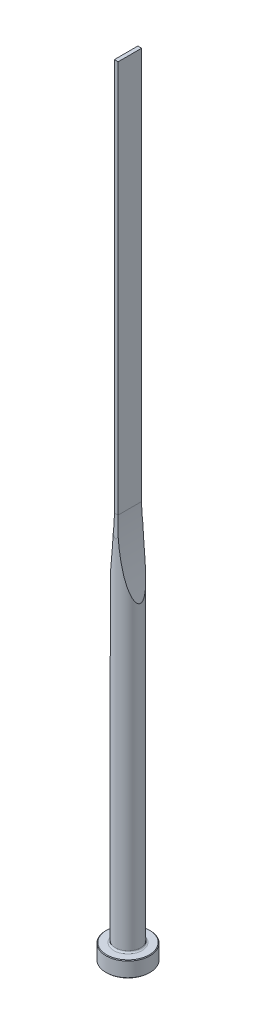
SolidWorks part; units mm, degrees
ref_plane "Front Plane" through (0, 0, 0) normal (0, 0, 1) x (1, 0, 0)
ref_plane "Top Plane" through (0, 0, 0) normal (0, 1, 0) x (1, 0, 0)
ref_plane "Right Plane" through (0, 0, 0) normal (1, 0, 0) x (0, 0, -1)
sketch "Sketch1" plane through (0, 0, 0) normal (0, 0, 1) x (1, 0, 0)
  line L0 (0, 0) -> (6.8, 0)
  line L1 (55, 0) -> (-55, 0) construction
  line L2 (7, 0.2) -> (7, 4.8)
  line L3 (6.8, 5) -> (4.5, 5)
  line L4 (4, 5.5) -> (4, 250)
  line L5 (0, 250) -> (4, 250)
  line L6 (7, 4.8) -> (6.8, 5)
  line L7 (6.8, 0) -> (7, 0.2)
  line L8 (0, 250) -> (0, 0)
  arc A0 (4, 5.5) -> (4.5, 5) centre (4.5, 5.5) ccw
  point P1 (7, 0)
  point P6 (7, 5)
  dimension "D4" = 0.5
  dimension "D1" = 4
  dimension "D2" = 7
  dimension "D3" = 5
  dimension "D5" = 250
revolve "Revolve1" add sketch "Sketch1" angle 360 about L8
sketch "Sketch2" plane through (0, 0, 0) normal (0, 0, 1) x (1, 0, 0)
  line L0 (0.6, 250) -> (0.6, 125)
  line L1 (4, 250) -> (-4, 250) construction
  line L2 (-0.6, 250) -> (-0.6, 125)
  line L3 (4, 250) -> (4, 100.4961)
  line L4 (-4, 250) -> (-4, 100.4961)
  line L5 (0, -7.7) -> (0, 7.7) construction
  line L6 (4, 250) -> (0.6, 250)
  line L8 (-0.6, 250) -> (-4, 250)
  arc A0 (0.6, 125) -> (4, 100.4961) centre (90.6, 125) ccw
  arc A1 (-0.6, 125) -> (-4, 100.4961) centre (-90.6, 125) cw
  dimension "D4" = 90
  dimension "D1" = 125
  dimension "D2" = 1.2
  dimension "D3" = 0.6
extrude "Cut-Extrude1" cut sketch "Sketch2" against normal mid plane 10
sketch "Sketch3" plane through (0, 0, 0) normal (1, 0, 0) x (0, 0, -1)
  line L0 (3.75, 250) -> (3.75, 125)
  line L1 (-3.9547, 250) -> (3.9547, 250) construction
  line L2 (-3.75, 250) -> (-3.75, 125)
  line L3 (4, 250) -> (4, 118.2965)
  line L4 (3.75, 250) -> (4, 250)
  line L5 (0, 7.7) -> (0, -7.7) construction
  line L6 (-4, 250) -> (-4, 118.2965)
  line L8 (-3.75, 250) -> (-4, 250)
  arc A0 (3.75, 125) -> (4, 118.2965) centre (93.75, 125) ccw
  arc A1 (-3.75, 125) -> (-4, 118.2965) centre (-93.75, 125) cw
  dimension "D2" = 90
  dimension "D1" = 125
  dimension "D3" = 7.5
  dimension "D4" = 3.75
extrude "Cut-Extrude2" cut sketch "Sketch3" against normal mid plane 10
